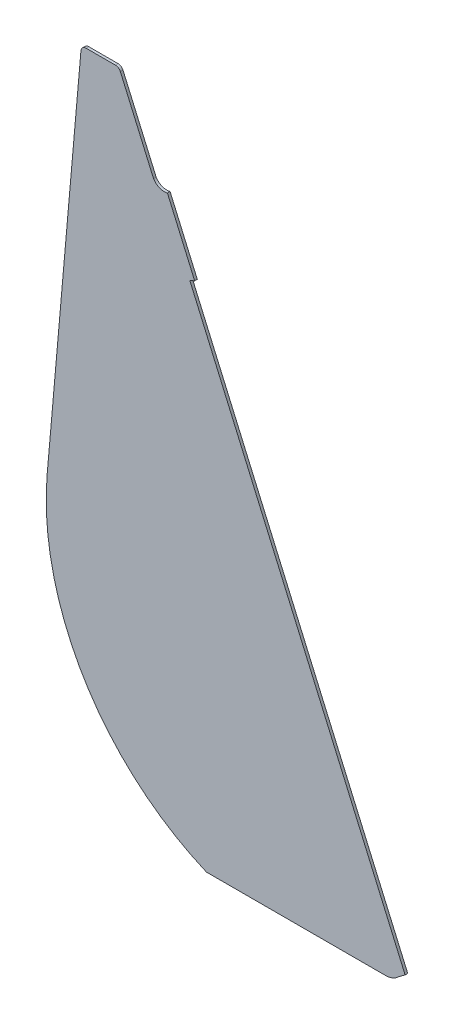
SolidWorks part; units mm, degrees
ref_plane "Front Plane" through (0, 0, 0) normal (0, 0, 1) x (1, 0, 0)
ref_plane "Top Plane" through (0, 0, 0) normal (0, 1, 0) x (1, 0, 0)
ref_plane "Right Plane" through (0, 0, 0) normal (1, 0, 0) x (0, 0, -1)
sketch "Sketch1" plane through (0, 0, 0) normal (0, 0, 1) x (1, 0, 0)
  line L0 (-126.8897, 291.0417) -> (-171.4165, 393.1708)
  line L1 (116.2771, -266.7) -> (0, 0)
  line L2 (0, 0) -> (-126.8897, 291.0417)
  line L3 (-275.6281, 489.507) -> (-316.2764, 27.8476)
  line L4 (-124.4341, -292.1) -> (91.44, -292.1)
  line L5 (-188.1337, 399.7369) -> (-224.2608, 482.6)
  line L6 (-138.5314, 285.9661) -> (-224.2608, 482.6) construction
  line L7 (-126.8897, 291.0417) -> (-215.9432, 495.3) construction
  line L8 (-224.2608, 482.6) -> (-228.1357, 491.4878)
  line L9 (-215.9432, 495.3) -> (-275.1181, 495.3) construction
  line L10 (-275.1181, 495.3) -> (-316.2764, 27.8476) construction
  line L11 (116.2771, -266.7) -> (120.261, -275.8378)
  line L12 (229.756, -194.7016) -> (107.3093, -285.4351) construction
  line L13 (120.261, -275.8378) -> (107.3093, -285.4351)
  line L14 (-233.9565, 495.3) -> (-269.3026, 495.3)
  line L19 (-224.2608, 482.6) -> (-263.4871, 482.6) construction
  line L20 (-263.4871, 482.6) -> (-303.6253, 26.7337) construction
  line L21 (-121.8141, -279.4) -> (91.44, -279.4) construction
  line L22 (104.5808, -271.6502) -> (98.7732, -275.9536) construction
  line L23 (104.5808, -271.6502) -> (104.5808, -271.6502) construction
  line L24 (104.5808, -271.6502) -> (104.5808, -271.6502) construction
  line L25 (104.5808, -271.6502) -> (-11.6417, -5.0756) construction
  line L26 (-11.6417, -5.0756) -> (-138.5314, 285.9661) construction
  line L27 (117.4707, -269.4377) -> (229.756, -194.7016) construction
  line L28 (116.2771, -266.7) -> (117.4707, -269.4377) construction
  arc A0 (-171.4165, 393.1708) -> (-188.1337, 399.7369) centre (-175.3724, 407.6631) cw
  arc A1 (-269.3026, 495.3) -> (-275.6281, 489.507) centre (-269.3026, 488.95) ccw
  arc A2 (-316.2764, 27.8476) -> (-124.4341, -292.1) centre (0, 0) ccw
  arc A3 (-228.1357, 491.4878) -> (-233.9565, 495.3) centre (-233.9565, 488.95) ccw
  arc A5 (91.44, -292.1) -> (107.3093, -285.4351) centre (91.44, -269.875) ccw
  arc A6 (-303.6253, 26.7337) -> (-121.8141, -279.4) centre (0, 0) ccw construction
  arc A7 (91.44, -279.4) -> (98.7732, -275.9536) centre (91.44, -269.875) ccw construction
  dimension "D1" = 292.1
  dimension "D4" = 12.7
  dimension "D6" = 635
  dimension "D7" = 787.4
  dimension "D8" = 44.45
  dimension "D2" = 12.7
  dimension "D3" = 12.7
  dimension "D5" = 143.461
  dimension "D9" = 269.875
  dimension "D10" = 91.44
extrude "Boss-Extrude2" add sketch "Sketch1" along normal blind 3.175
sketch "Sketch4" plane through (0, 0, 3.175) normal (0, 0, 1) x (1, 0, 0)
  circle A0 centre (91.44, -269.875) radius 6.35
  dimension "D3" = 12.7
  dimension "D1" = 269.875
  dimension "D2" = 91.44
sketch "Sketch5" plane through (0, 0, 0) normal (0, 0, -1) x (-1, 0, 0)
  line L0 (0, 0) -> (34.925, -15.2268) construction
  line L2 (-120.261, -275.8378) -> (171.4165, 393.1708) construction
  circle A0 centre (34.925, -15.2268) radius 3.175
  dimension "D2" = 6.35
  dimension "D1" = 38.1
sketch "Sketch6" plane through (0, 0, 0) normal (0.9167, 0.3997, 0) x (0, 0, -1)
  line L0 (-3.175, -300.9139) -> (-3.175, 428.9136) construction
  line L1 (0, -300.9139) -> (-3.175, -300.9139)
  line L2 (0, -300.9139) -> (0, 346.7861)
  line L3 (0, 346.7861) -> (-3.175, 346.7861)
  line L4 (-3.175, -300.9139) -> (-3.175, 346.7861)
  dimension "D1" = 647.7
extrude "Cut-Extrude1" cut sketch "Sketch6" against normal blind 6.35
sketch "Sketch7" plane through (120.261, -275.8378, 0) normal (-0.3997, 0.9167, 0) x (0.9167, 0.3997, 0)
  line L1 (0, -3.175) -> (-6.35, -3.175)
  line L2 (0, -3.175) -> (0, 0)
  line L3 (0, 0) -> (-6.35, 0)
  line L4 (-6.35, -3.175) -> (-6.35, 0)
extrude "Cut-Extrude2" cut sketch "Sketch7" against normal blind 2.54
sketch "Sketch8" plane through (0, 0, 0) normal (0, 0, 1) x (1, 0, 0)
  line L6 (-58.2083, -25.3779) -> (-304.6601, 9.233)
  line L7 (-128.8518, -276.225) -> (77.5859, -276.225)
  line L8 (90.2552, -254.6811) -> (-10.7481, -23.0139)
  line L14 (-288.1987, 197.2239) -> (-48.5172, 63.6155)
  line L15 (-48.5172, 63.6155) -> (-229.8073, 479.433)
  line L16 (-229.8073, 479.433) -> (-263.4871, 479.433)
  line L17 (-263.4871, 479.433) -> (-288.1987, 197.2239)
  circle A0 centre (-294.6756, 190.8901) radius 3.175
  arc A6 (-304.6601, 9.233) -> (-128.8518, -276.225) centre (0, 0) ccw
  arc A7 (90.2552, -254.6811) -> (77.5859, -276.225) centre (91.44, -269.875) ccw
  arc A8 (-58.2083, -25.3779) -> (-10.7481, -23.0139) centre (-34.925, -15.2268) ccw
